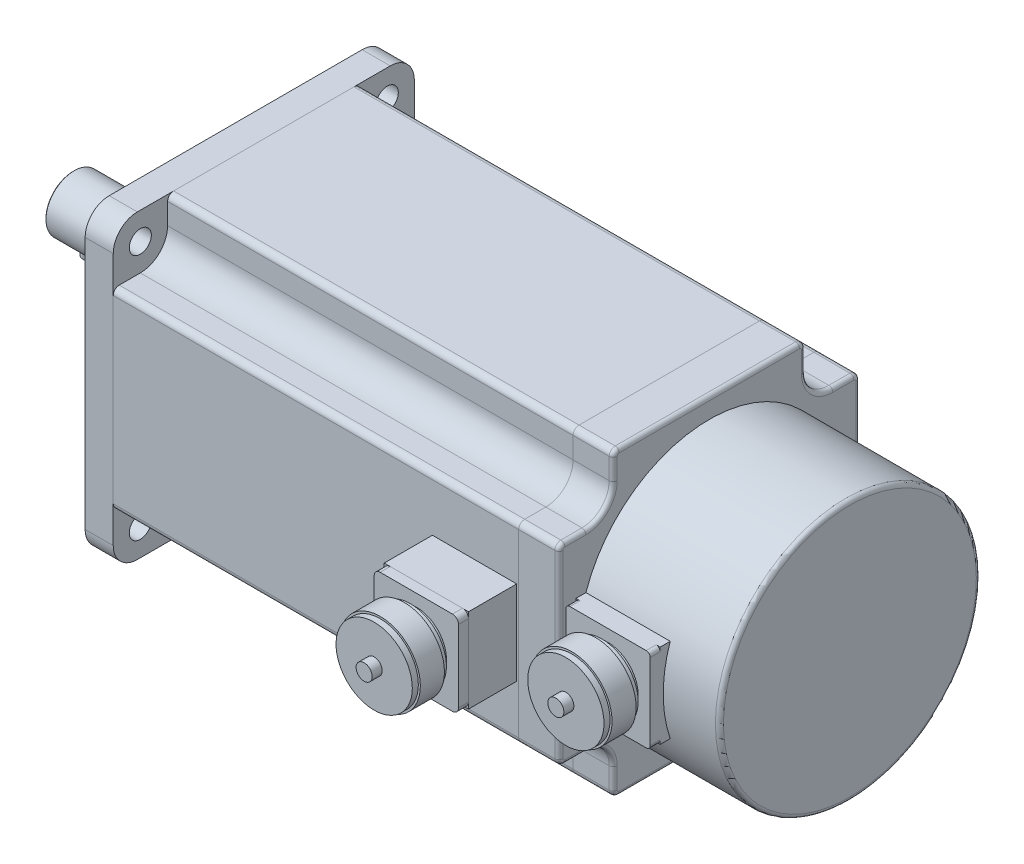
SolidWorks part; units mm, degrees
ref_plane "前视基准面" through (0, 0, 0) normal (0, 0, 1) x (1, 0, 0)
ref_plane "上视基准面" through (0, 0, 0) normal (0, 1, 0) x (1, 0, 0)
ref_plane "右视基准面" through (0, 0, 0) normal (1, 0, 0) x (0, 0, -1)
sketch "草图1" plane through (0, 0, 0) normal (1, 0, 0) x (0, 0, -1)
  line L1 (-63, -75) -> (63, -75)
  line L2 (-75, -63) -> (-75, 63)
  line L3 (-63, 75) -> (63, 75)
  line L4 (75, -63) -> (75, 63)
  line L5 (-75, -75) -> (75, 75) construction
  line L6 (-75, 75) -> (75, -75) construction
  arc A0 (63, -75) -> (75, -63) centre (63, -63) ccw
  arc A1 (-63, -75) -> (-75, -63) centre (-63, -63) cw
  arc A2 (-75, 63) -> (-63, 75) centre (-63, 63) cw
  arc A3 (63, 75) -> (75, 63) centre (63, 63) cw
  point P0 (0, 0)
  dimension "D1" = 12
extrude "凸台-拉伸1" add sketch "草图1" along normal blind 20
sketch "草图2" plane through (0, 0, 0) normal (-1, 0, 0) x (0, 0, 1)
  line L0 (-63, 75) -> (63, 75) construction
  line L1 (-63, -75) -> (63, -75)
  line L2 (-75, -63) -> (-75, 63)
  line L3 (-63, 75) -> (63, 75)
  line L4 (75, -63) -> (75, 63)
  line L5 (-75, -75) -> (75, 75) construction
  line L6 (-75, 75) -> (75, -75) construction
  arc A0 (63, 75) -> (75, 63) centre (63, 63) cw
  arc A1 (63, -75) -> (75, -63) centre (63, -63) ccw
  arc A2 (-63, -75) -> (-75, -63) centre (-63, -63) cw
  arc A3 (-75, 63) -> (-63, 75) centre (-63, 63) cw
  point P0 (0, 0)
  dimension "D1" = 12
extrude "凸台-拉伸2" add sketch "草图2" along normal blind 202 separate body
sketch "草图3" plane through (-202, 0, 0) normal (-1, 0, 0) x (0, 0, 1)
  line L0 (63, 75) -> (-63, 75) construction
  line L1 (-63, -75) -> (63, -75)
  line L2 (-75, -63) -> (-75, 63)
  line L3 (-63, 75) -> (63, 75)
  line L4 (75, -63) -> (75, 63)
  line L5 (-75, -75) -> (75, 75) construction
  line L6 (-75, 75) -> (75, -75) construction
  arc A0 (-63, -75) -> (-75, -63) centre (-63, -63) cw
  arc A1 (63, -75) -> (75, -63) centre (63, -63) ccw
  arc A2 (63, 75) -> (75, 63) centre (63, 63) cw
  arc A3 (-75, 63) -> (-63, 75) centre (-63, 63) cw
  point P0 (0, 0)
  dimension "D1" = 12
extrude "凸台-拉伸3" add sketch "草图3" along normal blind 14 separate body
sketch "草图4" plane through (0, 0, 75) normal (0, 0, 1) x (1, 0, 0)
  line L2 (-43, -21) -> (-1, -21)
  line L3 (-43, -21) -> (-43, 21)
  line L4 (-43, 21) -> (-1, 21)
  line L5 (-1, -21) -> (-1, 21)
  line L6 (-43, -21) -> (-1, 21) construction
  line L7 (-43, 21) -> (-1, -21) construction
extrude "凸台-拉伸4" add sketch "草图4" along normal blind 24 separate body
sketch "草图5" plane through (0, 0, 99) normal (0, 0, 1) x (1, 0, 0)
  line L0 (-1, 21) -> (-43, 21) construction
  line L1 (-40, -21) -> (-4, -21)
  line L2 (-43, -18) -> (-43, 18)
  line L3 (-40, 21) -> (-4, 21)
  line L4 (-1, -18) -> (-1, 18)
  line L5 (-43, -21) -> (-1, 21) construction
  line L6 (-43, 21) -> (-1, -21) construction
  arc A0 (-40, -21) -> (-43, -18) centre (-40, -18) cw
  arc A1 (-4, -21) -> (-1, -18) centre (-4, -18) ccw
  arc A2 (-4, 21) -> (-1, 18) centre (-4, 18) cw
  arc A3 (-43, 18) -> (-40, 21) centre (-40, 18) cw
  point P0 (-22, 0)
  dimension "D1" = 3
extrude "凸台-拉伸5" add sketch "草图5" along normal blind 5 separate body
sketch "草图6" plane through (0, 0, 104) normal (0, 0, 1) x (1, 0, 0)
  circle A0 centre (-22, 0) radius 15
extrude "凸台-拉伸6" add sketch "草图6" along normal blind 3 separate body
sketch "草图7" plane through (0, 0, 107) normal (0, 0, 1) x (1, 0, 0)
  circle A0 centre (-22, 0) radius 18
extrude "凸台-拉伸7" add sketch "草图7" along normal blind 3 separate body
sketch "草图8" plane through (0, 0, 110) normal (0, 0, 1) x (1, 0, 0)
  circle A0 centre (-22, 0) radius 20
extrude "凸台-拉伸8" add sketch "草图8" along normal blind 12 separate body
sketch "草图9" plane through (0, 0, 122) normal (0, 0, 1) x (1, 0, 0)
  circle A0 centre (-22, 0) radius 19
extrude "凸台-拉伸9" add sketch "草图9" along normal blind 3
sketch "草图10" plane through (0, 0, 125) normal (0, 0, 1) x (1, 0, 0)
  circle A0 centre (-22, 0) radius 4
extrude "凸台-拉伸10" add sketch "草图10" along normal blind 5
sketch "草图11" plane through (20, 0, 0) normal (1, 0, 0) x (0, 0, -1)
  line L0 (47.9169, -61.5) -> (47.9169, -72)
  line L1 (-75, -44.9169) -> (-75, -63)
  line L2 (-63, -75) -> (-44.9169, -75)
  line L3 (44.9169, -75) -> (63, -75)
  line L4 (75, -63) -> (75, -44.9169)
  line L6 (75, 63) -> (75, 44.9169)
  line L7 (-63, -75) -> (63, -75) construction
  line L8 (63, 75) -> (44.9169, 75)
  line L9 (-47.9169, -72) -> (-47.9169, -61.5)
  line L10 (-44.9169, 75) -> (-63, 75)
  line L11 (-61.5, -47.9169) -> (-72, -47.9169)
  line L12 (75, -63) -> (75, 63) construction
  line L13 (-75, 63) -> (-75, 44.9169)
  line L14 (-72, 47.9169) -> (-61.5, 47.9169)
  line L16 (-47.9169, 61.5) -> (-47.9169, 72)
  line L17 (63, 75) -> (-63, 75) construction
  line L19 (47.9169, 72) -> (47.9169, 61.5)
  line L21 (61.5, 47.9169) -> (72, 47.9169)
  line L22 (-75, 63) -> (-75, -63) construction
  line L24 (72, -47.9169) -> (61.5, -47.9169)
  arc A0 (-61.5, 47.9169) -> (-47.9169, 61.5) centre (-61.5, 61.5) ccw
  arc A1 (47.9169, 61.5) -> (61.5, 47.9169) centre (61.5, 61.5) ccw
  arc A2 (-47.9169, -61.5) -> (-61.5, -47.9169) centre (-61.5, -61.5) ccw
  arc A3 (-72, -47.9169) -> (-75, -44.9169) centre (-72, -44.9169) cw
  arc A4 (61.5, -47.9169) -> (47.9169, -61.5) centre (61.5, -61.5) ccw
  arc A5 (-75, 44.9169) -> (-72, 47.9169) centre (-72, 44.9169) cw
  arc A6 (-47.9169, 72) -> (-44.9169, 75) centre (-44.9169, 72) cw
  arc A7 (44.9169, 75) -> (47.9169, 72) centre (44.9169, 72) cw
  arc A8 (72, 47.9169) -> (75, 44.9169) centre (72, 44.9169) cw
  arc A9 (75, -44.9169) -> (72, -47.9169) centre (72, -44.9169) cw
  arc A10 (47.9169, -72) -> (44.9169, -75) centre (44.9169, -72) cw
  arc A11 (-44.9169, -75) -> (-47.9169, -72) centre (-44.9169, -72) cw
  arc A12 (-63, 75) -> (-75, 63) centre (-63, 63) ccw
  arc A13 (75, 63) -> (63, 75) centre (63, 63) ccw
  arc A14 (63, -75) -> (75, -63) centre (63, -63) ccw
  arc A15 (-75, -63) -> (-63, -75) centre (-63, -63) ccw
  point P0 (0, 0)
  point P1 (0, 0)
  point P12 (-75, -47.9169)
  point P43 (-75, 47.9169)
  point P47 (-47.9169, 75)
  point P48 (51.9891, -75)
  point P52 (47.9169, 75)
  point P56 (75, 47.9169)
  point P65 (75, -47.9169)
  point P82 (-47.9169, -75)
  dimension "D1" = 3
extrude "切除-拉伸2" cut sketch "草图11" against normal blind 222
fillet "圆角1" radius 2 24 edges at (20, 75, 0) (20, 0, -75) (20, -75, 0) (20, 0, 75) (20, 47.0382, 74.1213) (20, 47.9169, 66.75) (20, 51.8953, 51.8953) (20, 66.75, 47.9169) (20, 74.1213, 47.0382) (20, 74.1213, -47.0382) (20, 66.75, -47.9169) (20, 51.8953, -51.8953) (20, 47.9169, -66.75) (20, 47.0382, -74.1213) (20, -47.0382, -74.1213) (20, -47.9169, -66.75) (20, -51.8953, -51.8953) (20, -66.75, -47.9169) (20, -74.1213, -47.0382) (20, -74.1213, 47.0382) (20, -66.75, 47.9169) (20, -51.8953, 51.8953) (20, -47.9169, 66.75) (20, -47.0382, 74.1213)
sketch "草图12" plane through (-216, 0, 0) normal (-1, 0, 0) x (0, 0, 1)
  circle A2 centre (-61.5183, 61.5183) radius 5.5
  circle A3 centre (61.5183, 61.5183) radius 5.5
  circle A4 centre (-61.5183, -61.5183) radius 5.5
  circle A5 centre (61.5183, -61.5183) radius 5.5
extrude "切除-拉伸3" cut sketch "草图12" against normal blind 14
sketch "草图13" plane through (-216, 0, 0) normal (-1, 0, 0) x (0, 0, 1)
  circle A0 centre (0, 0) radius 65
  circle A1 centre (0, 0) radius 57.5
extrude "凸台-拉伸11" add sketch "草图13" along normal blind 6 separate body
sketch "草图14" plane through (-216, 0, 0) normal (-1, 0, 0) x (0, 0, 1)
  circle A0 centre (0, 0) radius 35
extrude "凸台-拉伸12" add sketch "草图14" along normal blind 6
sketch "草图15" plane through (-222, 0, 0) normal (-1, 0, 0) x (0, 0, 1)
  circle A0 centre (0, 0) radius 17.5
extrude "凸台-拉伸13" add sketch "草图15" along normal blind 3 separate body
fillet "圆角2" radius 0.5 1 edges at (-225, 0, 17.5)
sketch "草图16" plane through (-225, 0, 0) normal (-1, 0, 0) x (0, 0, 1)
  circle A0 centre (0, 0) radius 14
extrude "凸台-拉伸14" add sketch "草图16" along normal blind 72
chamfer "倒角1" distance 0.5 angle 45 1 edges at (-297, 0, 14)
ref_plane "基准面1" through (0, -14, 0) normal (0, 1, 0) x (1, 0, 0)
sketch "草图19" plane through (20, 0, 0) normal (1, 0, 0) x (0, 0, -1)
  circle A0 centre (0, 0) radius 65
extrude "凸台-拉伸16" add sketch "草图19" along normal blind 70 separate body
fillet "圆角3" radius 2 1 edges at (90, 0, -65)
ref_plane "基准面2" through (0, 0, 65) normal (0, 0, 1) x (1, 0, 0)
sketch "草图20" plane through (0, 0, 65) normal (0, 0, 1) x (1, 0, 0)
  line L1 (20, 65) -> (20, -65) construction
  line L3 (62, -21) -> (20, -21)
  line L4 (62, -21) -> (62, 21)
  line L5 (62, 21) -> (20, 21)
  line L6 (20, -21) -> (20, 21)
  line L7 (62, -21) -> (20, 21) construction
  line L8 (62, 21) -> (20, -21) construction
extrude "切除-拉伸5" cut sketch "草图20" against normal blind 10
sketch "草图21" plane through (0, 0, 55) normal (0, 0, 1) x (1, 0, 0)
  line L0 (62, 21) -> (20, 21) construction
  line L1 (20, -21) -> (62, -21)
  line L2 (20, -21) -> (20, 21)
  line L3 (20, 21) -> (62, 21)
  line L4 (62, -21) -> (62, 21)
  line L5 (20, -21) -> (62, 21) construction
  line L6 (20, 21) -> (62, -21) construction
  line L7 (20, 21) -> (62, 21) construction
  point P0 (41, 0)
extrude "凸台-拉伸17" add sketch "草图21" along normal blind 11.5
sketch "草图22" plane through (0, 0, 66.5) normal (0, 0, 1) x (1, 0, 0)
  line L0 (62, -21) -> (62, 21) construction
  line L1 (22, -21) -> (60, -21)
  line L2 (20, -19) -> (20, 19)
  line L3 (22, 21) -> (60, 21)
  line L4 (62, -19) -> (62, 19)
  line L5 (20, -21) -> (62, 21) construction
  line L6 (20, 21) -> (62, -21) construction
  line L7 (20, 21) -> (62, 21) construction
  arc A0 (22, -21) -> (20, -19) centre (22, -19) cw
  arc A1 (60, -21) -> (62, -19) centre (60, -19) ccw
  arc A2 (60, 21) -> (62, 19) centre (60, 19) cw
  arc A3 (20, 19) -> (22, 21) centre (22, 19) cw
  point P0 (41, 0)
  dimension "D1" = 2
extrude "凸台-拉伸18" add sketch "草图22" along normal blind 5 separate body
sketch "草图23" plane through (0, 0, 71.5) normal (0, 0, 1) x (1, 0, 0)
  circle A0 centre (41, 0) radius 15
extrude "凸台-拉伸19" add sketch "草图23" along normal blind 3
sketch "草图24" plane through (0, 0, 74.5) normal (0, 0, 1) x (1, 0, 0)
  circle A0 centre (41, 0) radius 18
extrude "凸台-拉伸20" add sketch "草图24" along normal blind 3
sketch "草图25" plane through (0, 0, 77.5) normal (0, 0, 1) x (1, 0, 0)
  circle A0 centre (41, 0) radius 20
extrude "凸台-拉伸21" add sketch "草图25" along normal blind 12
sketch "草图26" plane through (0, 0, 89.5) normal (0, 0, 1) x (1, 0, 0)
  circle A0 centre (41, 0) radius 19
extrude "凸台-拉伸22" add sketch "草图26" along normal blind 3
sketch "草图27" plane through (0, 0, 92.5) normal (0, 0, 1) x (1, 0, 0)
  circle A0 centre (41, 0) radius 4
extrude "凸台-拉伸23" add sketch "草图27" along normal blind 5
sketch "草图29" plane through (0, -14, 0) normal (0, 1, 0) x (1, 0, 0)
  line L3 (-288, -4) -> (-241, -4)
  line L5 (-241, 4) -> (-288, 4)
  arc A0 (-288, 4) -> (-288, -4) centre (-288, 0) ccw
  arc A1 (-241, -4) -> (-241, 4) centre (-241, 0) ccw
extrude "切除-拉伸6" cut sketch "草图29" along normal blind 4
sketch "草图30" plane through (0, -10, 0) normal (0, -1, 0) x (1, 0, 0)
  line L0 (-288, 4) -> (-241, 4)
  line L2 (-241, -4) -> (-288, -4)
  arc A0 (-288, 4) -> (-288, -4) centre (-288, 0) ccw
  arc A1 (-241, -4) -> (-241, 4) centre (-241, 0) ccw
extrude "凸台-拉伸24" add sketch "草图30" along normal blind 8 separate body
